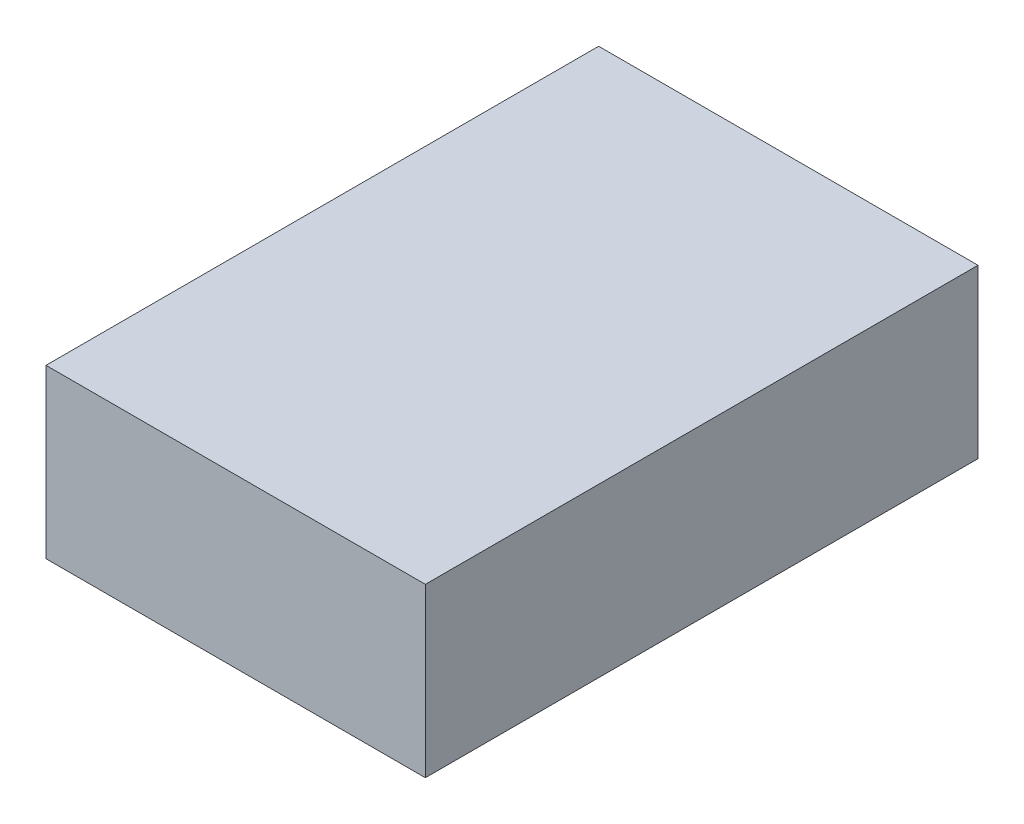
SolidWorks part; units mm, degrees
ref_plane "Front Plane" through (0, 0, 0) normal (0, 0, 1) x (1, 0, 0)
ref_plane "Top Plane" through (0, 0, 0) normal (0, 1, 0) x (1, 0, 0)
ref_plane "Right Plane" through (0, 0, 0) normal (1, 0, 0) x (0, 0, -1)
inserted part "body<1>@Assem1"
sketch "Sketch1" plane through (0, 0, 146.6) normal (0, 0, 1) x (1, 0, 0)
  line L0 (-102.9668, 0) -> (102.9668, 0)
  line L1 (-102.9668, 90.9341) -> (-102.9668, -90.9341) construction
  line L2 (102.9668, -90.9341) -> (102.9668, 90.9341) construction
split "Split1" trim tools "Sketch1" bodies to split 101 resulting bodies 102
